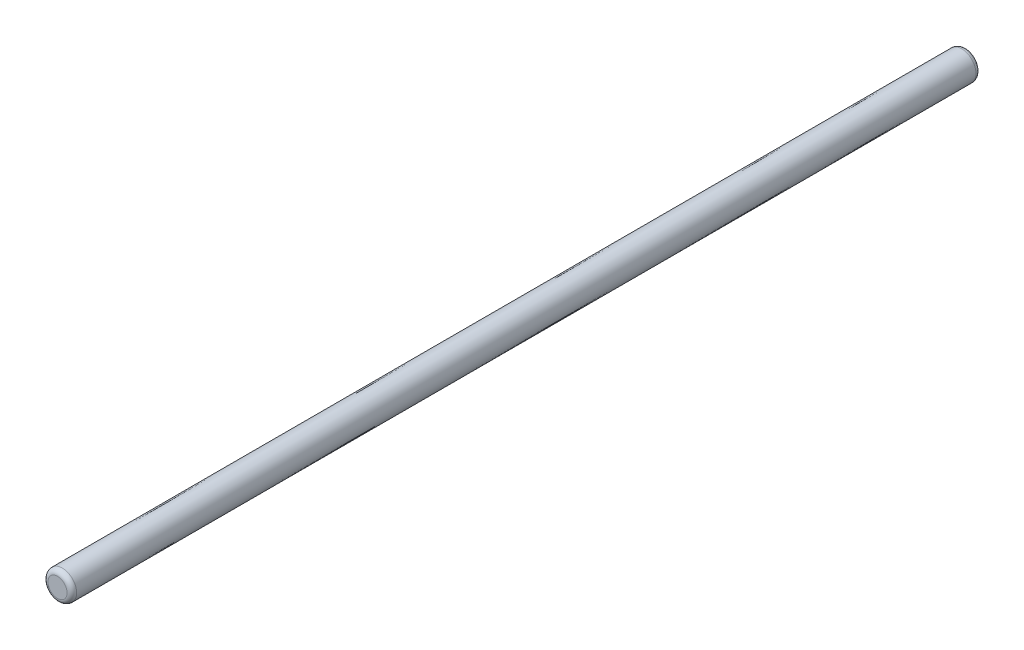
SolidWorks part; units mm, degrees
ref_plane "Plan1" through (0, 0, 0) normal (0, 0, 1) x (1, 0, 0)
ref_plane "Plan2" through (0, 0, 0) normal (0, 1, 0) x (1, 0, 0)
ref_plane "Plan3" through (0, 0, 0) normal (1, 0, 0) x (0, 0, -1)
sketch "Esquisse1" plane through (0, 0, 0) normal (0, 0, 1) x (1, 0, 0)
  circle A0 centre (0, 0) radius 1.5
  dimension "D1" = 3
extrude "Base-Extrusion" add sketch "Esquisse1" along normal mid plane 95
fillet "Congé1" radius 0.5 2 edges at (1.5, 0, -47.5) (1.5, 0, 47.5)
other "Fonction de déformation1"
